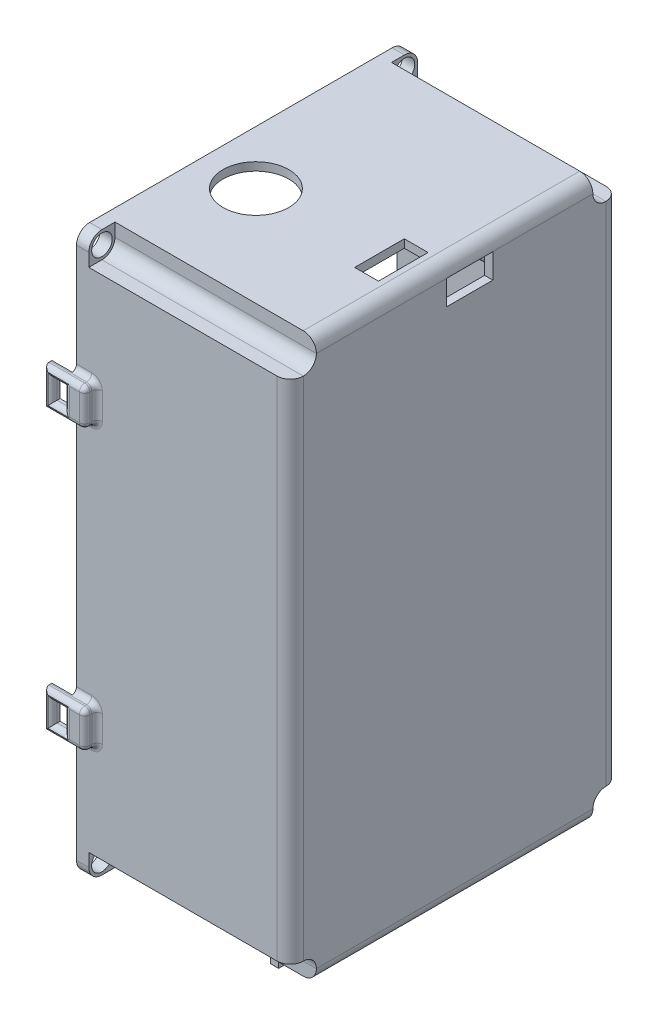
SolidWorks part; units mm, degrees
ref_plane "Front Plane" through (0, 0, 0) normal (0, 0, 1) x (1, 0, 0)
ref_plane "Top Plane" through (0, 0, 0) normal (0, 1, 0) x (1, 0, 0)
ref_plane "Right Plane" through (0, 0, 0) normal (1, 0, 0) x (0, 0, -1)
sketch "Sketch1" plane through (0, 0, 0) normal (1, 0, 0) x (0, 0, -1)
  line L1 (-31.75, -53.975) -> (31.75, -53.975)
  line L2 (-31.75, -53.975) -> (-31.75, 53.975)
  line L3 (-31.75, 53.975) -> (31.75, 53.975)
  line L4 (31.75, -53.975) -> (31.75, 53.975)
  line L5 (-31.75, -53.975) -> (31.75, 53.975) construction
  line L6 (-31.75, 53.975) -> (31.75, -53.975) construction
  point P0 (0, 0)
  dimension "D1" = 63.5
  dimension "D2" = 107.95
extrude "Boss-Extrude1" add sketch "Sketch1" along normal mid plane 41.275
shell "Shell1" thickness 1.5875
sketch "Sketch2" plane through (0, 0, 31.75) normal (0, 0, 1) x (1, 0, 0)
  line L0 (-20.6375, 53.975) -> (-20.6375, -53.975) construction
  line L1 (-24.6063, 23.4156) -> (-16.6687, 23.4156)
  line L2 (-24.6063, 23.4156) -> (-24.6063, 30.5594)
  line L3 (-24.6063, 30.5594) -> (-16.6687, 30.5594)
  line L4 (-16.6687, 23.4156) -> (-16.6687, 30.5594)
  line L5 (-24.6063, 23.4156) -> (-16.6687, 30.5594) construction
  line L6 (-24.6063, 30.5594) -> (-16.6687, 23.4156) construction
  line L7 (-20.6375, 0) -> (20.6375, 0) construction
  line L8 (20.6375, 53.975) -> (20.6375, -53.975) construction
  line L9 (-20.6375, 53.975) -> (-20.6375, 0) construction
  line L11 (-20.6375, 25.0031) -> (-23.0188, 25.0031)
  line L12 (-20.6375, 25.0031) -> (-20.6375, 28.9719)
  line L13 (-20.6375, 28.9719) -> (-23.0188, 28.9719)
  line L14 (-23.0188, 25.0031) -> (-23.0188, 28.9719)
  line L15 (-20.6375, 25.0031) -> (-23.0188, 28.9719) construction
  line L16 (-20.6375, 28.9719) -> (-23.0188, 25.0031) construction
  point P0 (-20.6375, 26.9875)
  point P14 (-20.6375, 26.9875)
  point P15 (-24.6062, 26.9875)
  point P16 (-21.8281, 26.9875)
  dimension "D1" = 7.1437
  dimension "D2" = 3.9688
  dimension "D3" = 1.5875
  dimension "D4" = 1.5875
extrude "Boss-Extrude2" add sketch "Sketch2" along normal blind 2.3812
mirror "Mirror1" about plane through (0, 0, 0) normal (0, 1, 0) of "Boss-Extrude2"
mirror "Mirror2" about plane through (0, 0, 0) normal (0, 0, 1) of "Mirror1", "Boss-Extrude2"
sketch "Sketch3" plane through (0, -53.975, 0) normal (0, -1, 0) x (1, 0, 0)
  line L0 (-20.6375, 31.75) -> (-20.6375, -31.75) construction
  line L1 (-20.6375, 15.875) -> (-2.6605, 15.875)
  line L2 (-20.6375, 15.875) -> (-20.6375, -15.875)
  line L3 (-20.6375, -15.875) -> (-2.6605, -15.875)
  line L4 (-2.6605, 15.875) -> (-2.6605, -15.875)
  point P6 (-2.6605, 0)
  dimension "D1" = 31.75
extrude "Cut-Extrude1" cut sketch "Sketch3" against normal blind 3.175
sketch "Sketch4" plane through (-24.6063, 0, 0) normal (-1, 0, 0) x (0, 0, 1)
  line L0 (34.1313, 23.4156) -> (31.75, 23.4156) construction
  line L1 (31.75, 30.5594) -> (32.5438, 30.5594)
  line L2 (31.75, 30.5594) -> (31.75, 23.4156)
  line L3 (31.75, 23.4156) -> (32.5438, 23.4156)
  line L4 (32.5438, 30.5594) -> (32.5438, 23.4156)
  dimension "D1" = 0.7937
extrude "Cut-Extrude2" cut sketch "Sketch4" against normal up to surface (3.9688 mm away)
mirror "Mirror3" about plane through (0, 0, 0) normal (0, 0, 1) of "Cut-Extrude2"
mirror "Mirror4" about plane through (0, 0, 0) normal (0, 1, 0) of "Mirror3", "Cut-Extrude2"
fillet "Fillet1" radius 2.54 7 edges at (20.6375, -53.975, 0) (20.6375, 0, 31.75) (20.6375, 53.975, 0) (20.6375, 0, -31.75) (-11.649, -53.975, -15.875) (-11.649, -53.975, 15.875) (-2.6605, -53.975, 0)
fillet "Fillet4" radius 1.016 52 edges at (-18.6531, 23.4156, 31.75) (-18.6531, 30.5594, 31.75) (-18.6531, -30.5594, 31.75) (-18.6531, -23.4156, 31.75) (-18.6531, -23.4156, -31.75) (-18.6531, -30.5594, -31.75) (-18.6531, 30.5594, -31.75) (-18.6531, 23.4156, -31.75) (-21.8281, 25.0031, 34.1313) (-20.6375, 26.9875, 34.1313) (-21.8281, 28.9719, 34.1313) (-23.0188, 26.9875, 34.1313) (-20.6375, 23.4156, 34.1313) (-24.6063, 26.9875, 34.1313) (-20.6375, 30.5594, 34.1313) (-16.6687, 23.4156, 32.9406) (-16.6687, 26.9875, 34.1313) (-16.6687, 30.5594, 32.9406) (-16.6687, 26.9875, 31.75) (-20.6375, -30.5594, 34.1313) (-24.6063, -26.9875, 34.1313) (-20.6375, -23.4156, 34.1313) (-23.0188, -26.9875, 34.1313) (-20.6375, -26.9875, 34.1313) (-21.8281, -25.0031, 34.1313) (-21.8281, -28.9719, 34.1313) (-16.6687, -30.5594, 32.9406) (-16.6687, -26.9875, 34.1313) (-16.6687, -23.4156, 32.9406) (-16.6687, -26.9875, 31.75) (-21.8281, -25.0031, -34.1313) (-20.6375, -26.9875, -34.1313) (-21.8281, -28.9719, -34.1313) (-23.0188, -26.9875, -34.1313) (-20.6375, -23.4156, -34.1313) (-24.6063, -26.9875, -34.1313) (-20.6375, -30.5594, -34.1313) (-16.6687, -23.4156, -32.9406) (-16.6687, -26.9875, -34.1313) (-16.6687, -30.5594, -32.9406) (-16.6687, -26.9875, -31.75) (-20.6375, 30.5594, -34.1313) (-24.6063, 26.9875, -34.1313) (-20.6375, 23.4156, -34.1313) (-20.6375, 26.9875, -34.1313) (-21.8281, 25.0031, -34.1313) (-23.0188, 26.9875, -34.1313) (-21.8281, 28.9719, -34.1313) (-16.6687, 30.5594, -32.9406) (-16.6687, 26.9875, -34.1313) (-16.6687, 23.4156, -32.9406) (-16.6687, 26.9875, -31.75)
sketch "Sketch7" plane through (19.05, 0, 0) normal (-1, 0, 0) x (0, 0, 1)
  line L1 (-30.1625, 52.3875) -> (30.1625, 52.3875) construction
  line L2 (-30.1625, -52.3875) -> (-30.1625, 52.3875) construction
  circle A0 centre (-13.5636, 46.0375) radius 2.3812
  circle A1 centre (13.5636, 46.0375) radius 2.3812
  circle A2 centre (-13.5636, 46.0375) radius 1.4351
  circle A3 centre (13.5636, 46.0375) radius 1.4351
  dimension "D1" = 4.7625
  dimension "D6" = 2.8702
  dimension "D2" = 6.35
  dimension "D3" = 16.5989
  dimension "D4" = 43.7261
  dimension "D5" = 6.35
extrude "Boss-Extrude4" add sketch "Sketch7" along normal blind 5.588
sketch "Sketch8" plane through (0, 53.975, 0) normal (0, 1, 0) x (1, 0, 0)
  line L1 (12.4763, -1.5563) -> (17.0638, -1.5563)
  line L2 (12.4763, -1.5563) -> (12.4764, -11.1438)
  line L3 (12.4764, -11.1438) -> (17.0638, -11.1438)
  line L4 (17.0638, -1.5563) -> (17.0638, -11.1438)
  line L5 (17.0638, -11.1438) -> (12.4763, -1.5563) construction
  line L6 (12.4764, -11.1438) -> (17.0638, -1.5563) construction
  line L10 (18.0975, -31.75) -> (18.0975, 31.75) construction
  line L11 (18.0975, 31.75) -> (-20.6375, 31.75) construction
  point P0 (14.7701, -6.35)
  dimension "D1" = 9.5875
  dimension "D2" = 4.5875
  dimension "D3" = 38.1
  dimension "D4" = 3.3274
extrude "Cut-Extrude3" cut sketch "Sketch8" against normal blind 5.08
sketch "Sketch9" plane through (19.05, 0, 0) normal (-1, 0, 0) x (0, 0, 1)
  line L0 (25.8636, -29.845) -> (27.4511, -29.845)
  line L1 (25.8636, 15.875) -> (27.4511, 15.875)
  line L2 (25.8636, 15.875) -> (25.8636, 12.7)
  line L3 (25.8636, 12.7) -> (27.4511, 12.7)
  line L4 (27.4511, 15.875) -> (27.4511, 12.7)
  line L5 (25.8636, 15.875) -> (27.4511, 12.7) construction
  line L6 (25.8636, 12.7) -> (27.4511, 15.875) construction
  line L11 (25.8636, -29.845) -> (25.8636, -33.02)
  line L12 (25.8636, -33.02) -> (27.4511, -33.02)
  line L17 (27.4511, -29.845) -> (27.4511, -33.02)
  line L18 (25.8636, -29.845) -> (27.4511, -33.02) construction
  line L23 (25.8636, -33.02) -> (27.4511, -29.845) construction
  line L24 (-27.451, -29.845) -> (-25.8635, -29.845)
  line L25 (-27.451, -29.845) -> (-27.451, -33.02)
  line L26 (-27.451, -33.02) -> (-25.8635, -33.02)
  line L27 (-25.8635, -29.845) -> (-25.8635, -33.02)
  line L28 (-27.451, -29.845) -> (-25.8635, -33.02) construction
  line L29 (-27.451, -33.02) -> (-25.8635, -29.845) construction
  line L30 (-27.4511, 15.875) -> (-25.8636, 15.875)
  line L31 (-27.4511, 15.875) -> (-27.4511, 12.7)
  line L32 (-27.4511, 12.7) -> (-25.8636, 12.7)
  line L33 (-25.8636, 15.875) -> (-25.8636, 12.7)
  line L34 (-27.4511, 15.875) -> (-25.8636, 12.7) construction
  line L35 (-27.4511, 12.7) -> (-25.8636, 15.875) construction
  line L36 (25.8636, -6.985) -> (27.4511, -6.985)
  line L37 (25.8636, -6.985) -> (25.8636, -10.16)
  line L38 (25.8636, -10.16) -> (27.4511, -10.16)
  line L39 (27.4511, -6.985) -> (27.4511, -10.16)
  line L40 (25.8636, -6.985) -> (27.4511, -10.16) construction
  line L41 (25.8636, -10.16) -> (27.4511, -6.985) construction
  line L42 (-27.4511, -6.985) -> (-25.8636, -6.985)
  line L43 (-27.4511, -6.985) -> (-27.4511, -10.16)
  line L44 (-27.4511, -10.16) -> (-25.8636, -10.16)
  line L45 (-25.8636, -6.985) -> (-25.8636, -10.16)
  line L46 (-27.4511, -6.985) -> (-25.8636, -10.16) construction
  line L47 (-27.4511, -10.16) -> (-25.8636, -6.985) construction
  line L48 (26.6573, 14.2875) -> (-26.6573, 14.2875) construction
  line L54 (-30.1625, -52.3875) -> (-30.1625, 52.3875) construction
  line L55 (-30.1625, 52.3875) -> (30.1625, 52.3875) construction
  point P0 (26.6573, 14.2875)
  point P6 (26.6573, -31.4325)
  point P11 (-26.6573, -31.4325)
  point P16 (-26.6573, 14.2875)
  point P21 (26.6573, -8.5725)
  point P26 (-26.6573, -8.5725)
  point P32 (0, 14.2875)
  dimension "D1" = 3.175
  dimension "D2" = 1.5875
  dimension "D3" = 53.3146
  dimension "D4" = 22.86
  dimension "D5" = 22.86
  dimension "D6" = 30.1625
  dimension "D7" = 38.1
extrude "Boss-Extrude5" add sketch "Sketch9" along normal blind 8.1216
sketch "Sketch10" plane through (0, 0, 25.8636) normal (0, 0, -1) x (-1, 0, 0)
  line L1 (-10.9284, -6.985) -> (-12.5158, -6.985)
  line L2 (-10.9284, -6.985) -> (-10.9284, -10.16)
  line L3 (-10.9284, -10.16) -> (-12.5158, -10.16)
  line L4 (-12.5158, -6.985) -> (-12.5158, -10.16)
  dimension "D1" = 1.5875
extrude "Boss-Extrude6" add sketch "Sketch10" along normal blind 1.5875
ref_plane "Plane1" through (0, 2.8575, 0) normal (0, 1, 0) x (1, 0, 0)
ref_plane "Plane2" through (0, -20.0025, 0) normal (0, -1, 0) x (-1, 0, 0)
mirror "Mirror5" about plane through (0, 2.8575, 0) normal (0, 1, 0) of "Boss-Extrude6"
mirror "Mirror6" about plane through (0, -20.0025, 0) normal (0, -1, 0) of "Mirror5", "Boss-Extrude6"
mirror "Mirror7" about plane through (0, 0, 0) normal (0, 0, 1) of "Mirror6", "Boss-Extrude6", "Mirror5"
fillet "Fillet6" radius 1.5875 6 edges at (10.9284, 14.2875, -24.2761) (10.9284, -8.5725, -24.2761) (10.9284, -31.4325, -24.2761) (10.9284, -31.4325, 24.2761) (10.9284, -8.5725, 24.2761) (10.9284, 14.2875, 24.2761)
fillet "Fillet7" radius 1.5875 18 edges at (19.05, 12.7, -26.6573) (19.05, 14.2875, -27.4511) (19.05, 15.875, -26.6573) (19.05, 15.875, 26.6573) (19.05, 12.7, 26.6573) (19.05, -10.16, 26.6573) (19.05, -6.985, 26.6573) (19.05, -29.845, 26.6573) (19.05, -33.02, 26.6573) (19.05, -33.02, -26.6573) (19.05, -29.845, -26.6573) (19.05, -10.16, -26.6573) (19.05, -6.985, -26.6573) (19.05, -8.5725, -27.4511) (19.05, -31.4325, -27.451) (19.05, -31.4325, 27.4511) (19.05, -8.5725, 27.4511) (19.05, 14.2875, 27.4511)
sketch "Sketch13" plane through (-20.6375, 0, 0) normal (-1, 0, 0) x (0, 0, 1)
  line L0 (-31.75, 53.975) -> (31.75, 53.975) construction
  line L1 (31.75, 53.975) -> (31.75, 31.5754) construction
  line L2 (-31.75, 31.5754) -> (-31.75, 53.975) construction
  line L5 (-31.75, -53.975) -> (-31.75, -31.5754) construction
  line L6 (-18.2296, -53.975) -> (-31.75, -53.975) construction
  line L7 (31.75, -31.5754) -> (31.75, -53.975) construction
  line L8 (31.75, -53.975) -> (18.2296, -53.975) construction
  circle A0 centre (28.429, 50.6539) radius 3.3211
  circle A1 centre (-28.429, 50.6539) radius 3.3211
  circle A2 centre (-28.429, -50.6539) radius 3.3211
  circle A3 centre (28.429, -50.6539) radius 3.3211
  dimension "D1" = 6.6421
extrude "Boss-Extrude7" add sketch "Sketch13" against normal up to surface (39.6875 mm away)
sketch "Sketch14" plane through (20.6375, 0, 0) normal (1, 0, 0) x (0, 0, -1)
  line L0 (26.6954, -51.4477) -> (26.6954, -53.975)
  line L1 (31.75, 50.6539) -> (31.75, -50.6539) construction
  line L2 (-28.429, 53.975) -> (28.429, 53.975) construction
  line L3 (-31.75, -50.6539) -> (-31.75, 50.6539) construction
  line L4 (28.429, -53.975) -> (-28.429, -53.975) construction
  line L13 (-26.6954, 51.4477) -> (-26.6954, 53.975)
  line L14 (-26.6954, 53.975) -> (-31.75, 53.975)
  line L15 (-31.75, 53.975) -> (-31.75, 48.9204)
  line L16 (-31.75, 48.9204) -> (-29.2227, 48.9204)
  line L17 (26.6954, 51.4477) -> (26.6954, 53.975)
  line L18 (26.6954, 53.975) -> (31.75, 53.975)
  line L19 (31.75, 53.975) -> (31.75, 48.9204)
  line L20 (31.75, 48.9204) -> (29.2227, 48.9204)
  line L21 (26.6954, -53.975) -> (31.75, -53.975)
  line L22 (31.75, -53.975) -> (31.75, -48.9204)
  line L23 (31.75, -48.9204) -> (29.2227, -48.9204)
  line L24 (-29.2227, -48.9204) -> (-31.75, -48.9204)
  line L25 (-31.75, -48.9204) -> (-31.75, -53.975)
  line L26 (-31.75, -53.975) -> (-26.6954, -53.975)
  line L27 (-26.6954, -53.975) -> (-26.6954, -51.4477)
  arc A0 (26.6954, 51.4477) -> (29.2227, 48.9204) centre (29.2227, 51.4477) ccw
  arc A1 (-29.2227, 48.9204) -> (-26.6954, 51.4477) centre (-29.2227, 51.4477) ccw
  arc A3 (-26.6954, -51.4477) -> (-29.2227, -48.9204) centre (-29.2227, -51.4477) ccw
  arc A4 (29.2227, -48.9204) -> (26.6954, -51.4477) centre (29.2227, -51.4477) ccw
  dimension "D1" = 5.0546
extrude "Cut-Extrude4" cut sketch "Sketch14" against normal offset from surface (38.8938 mm away) 2.3812
fillet "Fillet8" radius 2.54 4 edges at (-19.4469, -53.975, -31.75) (-19.4469, -53.975, 31.75) (-19.4469, 53.975, 31.75) (-19.4469, 53.975, -31.75)
sketch "Sketch15" plane through (-18.2563, 0, 0) normal (1, 0, 0) x (0, 0, -1)
  circle A0 centre (-29.21, 51.435) radius 1.9844
  circle A1 centre (29.21, 51.435) radius 1.9844
  circle A2 centre (29.21, -51.435) radius 1.9844
  circle A3 centre (-29.2227, -51.4477) radius 1.9844
  dimension "D1" = 3.9688
extrude "Cut-Extrude5" cut sketch "Sketch15" against normal through all
sketch "Sketch16" plane through (19.05, 0, 0) normal (-1, 0, 0) x (0, 0, 1)
  line L5 (22.225, -44.45) -> (-22.225, -44.45) construction
  line L6 (22.225, -44.45) -> (22.225, 44.45) construction
  line L7 (22.225, 44.45) -> (-22.225, 44.45) construction
  line L8 (-22.225, -44.45) -> (-22.225, 44.45) construction
  line L9 (22.225, -44.45) -> (-22.225, 44.45) construction
  line L10 (22.225, 44.45) -> (-22.225, -44.45) construction
  circle A0 centre (22.225, 44.45) radius 2.7813
  circle A1 centre (-22.225, 44.45) radius 2.7813
  circle A2 centre (22.225, -44.45) radius 2.7813
  circle A3 centre (-22.225, -44.45) radius 2.7813
  circle A4 centre (-22.225, 44.45) radius 1.4351
  circle A5 centre (22.225, 44.45) radius 1.4351
  circle A6 centre (22.225, -44.45) radius 1.4351
  circle A7 centre (-22.225, -44.45) radius 1.4351
  point P2 (0, 0)
  dimension "D1" = 5.5626
  dimension "D6" = 2.8702
  dimension "D2" = 44.45
  dimension "D3" = 88.9
extrude "Boss-Extrude8" add sketch "Sketch16" along normal blind 11.1125
fillet "Fillet9" radius 3.81 6 edges at (19.05, -44.45, 25.0063) (19.05, -44.45, -19.4437) (19.05, 44.45, 25.0063) (19.05, 46.0375, 15.9448) (19.05, 46.0375, -11.1823) (19.05, 44.45, -19.4437)
sketch "Sketch17" plane through (0, 53.975, 0) normal (0, 1, 0) x (1, 0, 0)
  circle A0 centre (-10.2524, -7.4838) radius 6.35
  dimension "D1" = 12.7
  dimension "D2" = 10.2524
  dimension "D3" = 7.4838
extrude "Cut-Extrude6" cut sketch "Sketch17" against normal blind 2.54
sketch "Sketch18" plane through (20.6375, 0, 0) normal (1, 0, 0) x (0, 0, -1)
  line L0 (-1.5563, 52.3875) -> (-1.5563, 53.975) construction
  line L1 (7.3724, 51.435) -> (-1.5563, 51.435)
  line L2 (7.3724, 51.435) -> (7.3724, 46.6725)
  line L3 (7.3724, 46.6725) -> (-1.5563, 46.6725)
  line L4 (-1.5563, 51.435) -> (-1.5563, 46.6725)
  line L5 (26.6954, 51.435) -> (-26.6954, 51.435) construction
  arc A0 (18.4431, 49.8483) -> (16.7743, 40.7439) centre (13.5636, 46.0375) ccw construction
  dimension "D1" = 4.7625
extrude "Cut-Extrude7" cut sketch "Sketch18" against normal through all
